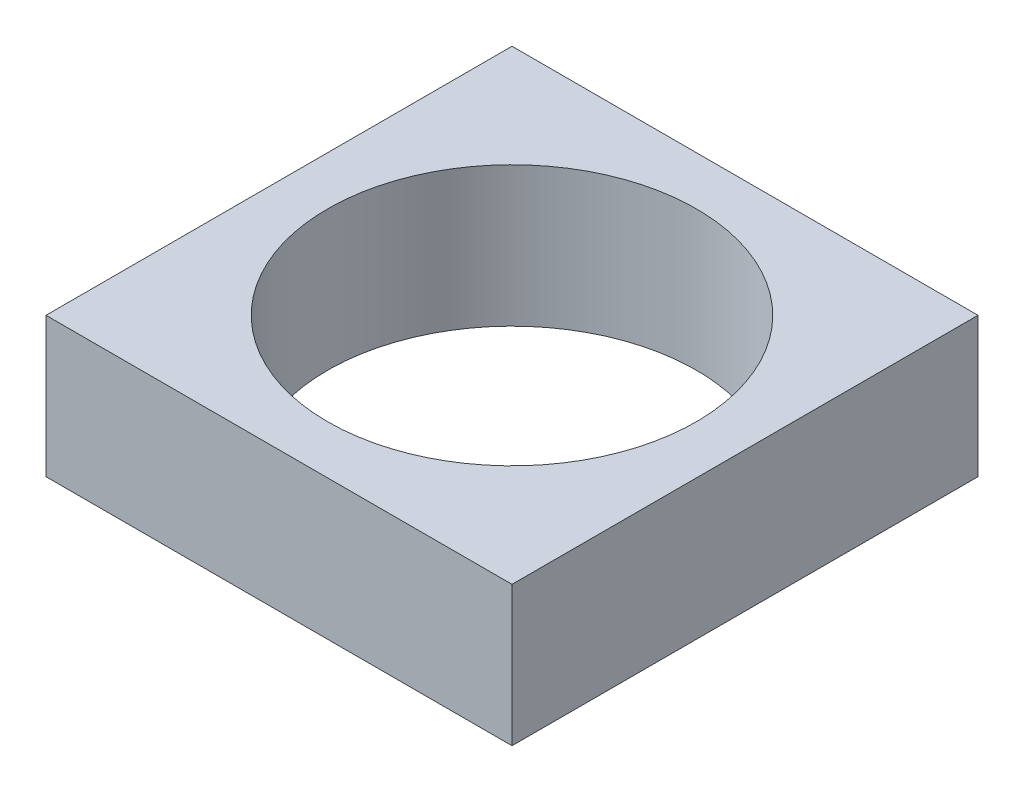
SolidWorks part; units mm, degrees
ref_plane "Plan de face" through (0, 0, 0) normal (0, 0, 1) x (1, 0, 0)
ref_plane "Plan de dessus" through (0, 0, 0) normal (0, 1, 0) x (1, 0, 0)
ref_plane "Plan de droite" through (0, 0, 0) normal (1, 0, 0) x (0, 0, -1)
sketch "Esquisse1" plane through (0, 0, 0) normal (0, 1, 0) x (1, 0, 0)
  line L1 (500, -500) -> (-500, -500)
  line L2 (500, -500) -> (500, 500)
  line L3 (500, 500) -> (-500, 500)
  line L4 (-500, -500) -> (-500, 500)
  line L5 (500, -500) -> (-500, 500) construction
  line L6 (500, 500) -> (-500, -500) construction
  circle A0 centre (0, 0) radius 395.6916
  point P0 (0, 0)
  dimension "D1" = 1000
  dimension "1000" = 1000
extrude "Boss.-Extru.1" add sketch "Esquisse1" along normal blind 300
